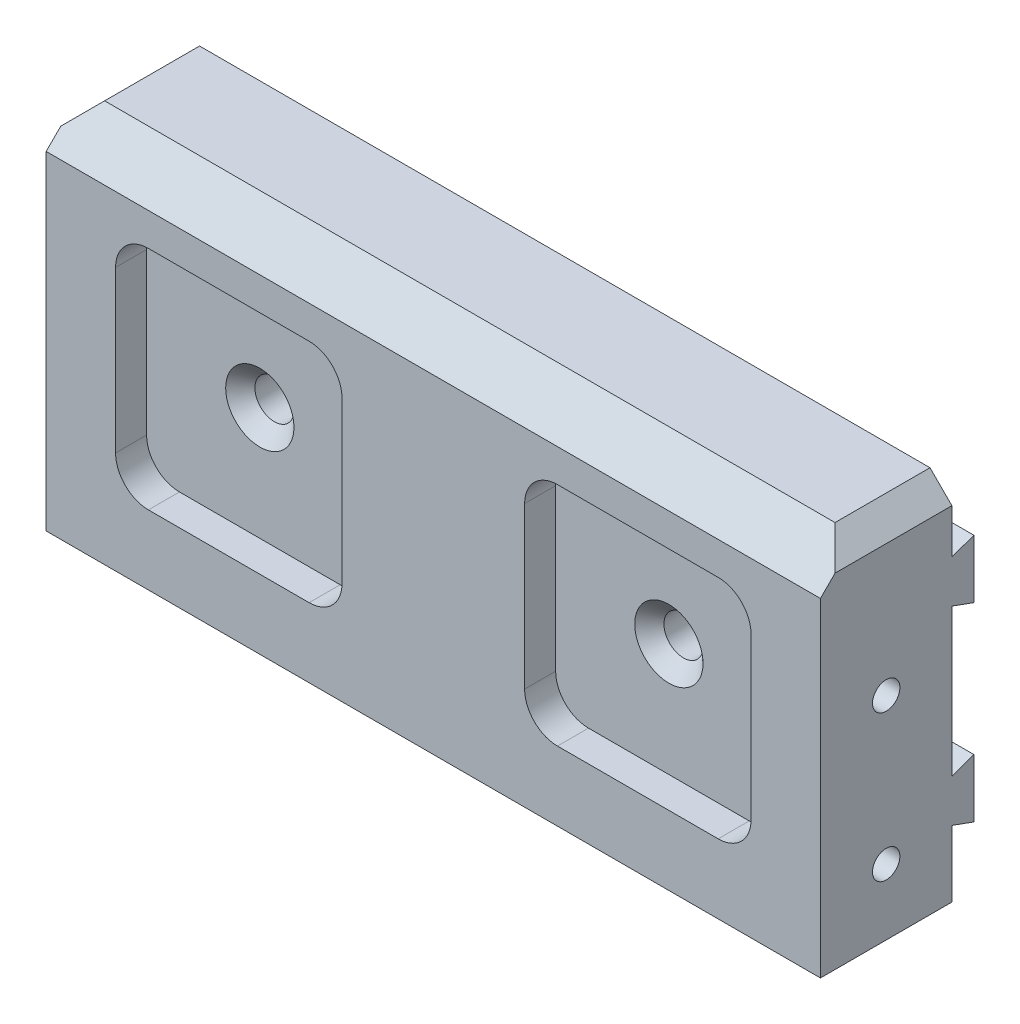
SolidWorks part; units mm, degrees
ref_plane "Спереди" through (0, 0, 0) normal (0, 0, 1) x (1, 0, 0)
ref_plane "Сверху" through (0, 0, 0) normal (0, 1, 0) x (1, 0, 0)
ref_plane "Справа" through (0, 0, 0) normal (1, 0, 0) x (0, 0, -1)
sketch "Эскиз1" plane through (0, 0, 0) normal (0, 0, 1) x (1, 0, 0)
  line L1 (-53, -25) -> (53, -25)
  line L2 (-53, -25) -> (-53, 25)
  line L3 (-53, 25) -> (53, 25)
  line L4 (53, -25) -> (53, 25)
  line L5 (-53, -25) -> (53, 25) construction
  line L6 (-53, 25) -> (53, -25) construction
  point P0 (0, 0)
  dimension "D1" = 106
  dimension "D2" = 50
extrude "Бобышка-Вытянуть1" add sketch "Эскиз1" along normal mid plane 18
chamfer "Фаска1" distance 5 angle 45 1 edges at (0, 25, 9)
sketch "Эскиз2" plane through (0, 0, 9) normal (0, 0, 1) x (1, 0, 0)
  line L4 (0, 0) -> (0, 33.1018) construction
  line L5 (0, -50) -> (0, 50) construction
  line L6 (-12.5, 11) -> (-12.5, -11)
  line L7 (-17, -15.5) -> (-39, -15.5)
  line L8 (43.5, -11) -> (43.5, 11)
  line L9 (39, 15.5) -> (17, 15.5)
  line L10 (17, -15.5) -> (39, -15.5)
  line L11 (12.5, 11) -> (12.5, -11)
  line L12 (43.5, -11) -> (43.5, 11)
  line L13 (39, 15.5) -> (17, 15.5)
  line L14 (17, -15.5) -> (39, -15.5)
  line L15 (12.5, 11) -> (12.5, -11)
  line L16 (-39, 15.5) -> (-17, 15.5)
  line L17 (-43.5, -11) -> (-43.5, 11)
  arc A4 (-12.5, -11) -> (-17, -15.5) centre (-17, -11) cw
  arc A5 (-17, 15.5) -> (-12.5, 11) centre (-17, 11) cw
  arc A6 (-43.5, 11) -> (-39, 15.5) centre (-39, 11) cw
  arc A7 (-39, -15.5) -> (-43.5, -11) centre (-39, -11) cw
  arc A8 (39, -15.5) -> (43.5, -11) centre (39, -11) ccw
  arc A9 (43.5, 11) -> (39, 15.5) centre (39, 11) ccw
  arc A10 (17, 15.5) -> (12.5, 11) centre (17, 11) ccw
  arc A11 (12.5, -11) -> (17, -15.5) centre (17, -11) ccw
  arc A12 (39, -15.5) -> (43.5, -11) centre (39, -11) ccw
  arc A13 (43.5, 11) -> (39, 15.5) centre (39, 11) ccw
  arc A14 (17, 15.5) -> (12.5, 11) centre (17, 11) ccw
  arc A15 (12.5, -11) -> (17, -15.5) centre (17, -11) ccw
  dimension "D1" = 0.5
extrude "Вырез-Вытянуть1" cut sketch "Эскиз2" against normal blind 4.25
sketch "Эскиз3" plane through (0, 0, -9) normal (0, 0, -1) x (-1, 0, 0)
  circle A0 centre (28, 0) radius 5 construction
  circle A1 centre (-28, 0) radius 5 construction
  circle A2 centre (28, 0) radius 5 construction
  circle A3 centre (-28, 0) radius 5 construction
  circle A4 centre (-28, 0) radius 2.675
  circle A5 centre (28, 0) radius 2.675
  dimension "D1" = 5.35
extrude "Вырез-Вытянуть2" cut sketch "Эскиз3" against normal through all
chamfer "Фаска2" distance 3 angle 45 2 edges at (-30.675, 0, -9) (25.325, 0, -9)
sketch "Эскиз4" plane through (-53, 0, 0) normal (-1, 0, 0) x (0, 0, 1)
  line L3 (-81.0045, 17) -> (-84.0045, 15.9081) construction
  line L4 (-81.0045, 9) -> (-81.0045, 17) construction
  line L5 (-84.0045, 10.0919) -> (-81.0045, 9) construction
  line L6 (-46.5023, 15.4081) -> (-46.5023, 2.7987) construction
  line L7 (-9, 10.0919) -> (-12, 9)
  line L8 (-12, 9) -> (-12, 17)
  line L9 (-12, 17) -> (-9, 15.9081)
  line L10 (-9, 15.9081) -> (-9, 10.0919)
  line L12 (0, 0) -> (-12.3873, 0) construction
  line L13 (-9, -15.9081) -> (-9, -10.0919)
  line L14 (-12, -17) -> (-9, -15.9081)
  line L15 (-12, -9) -> (-12, -17)
  line L16 (-9, -10.0919) -> (-12, -9)
  line L17 (-81.0045, 17) -> (-84.0045, 15.9081) construction
  line L18 (-81.0045, 9) -> (-81.0045, 17) construction
  line L19 (-84.0045, 10.0919) -> (-81.0045, 9) construction
  line L20 (-12, 13) -> (-10.2962, 13) construction
  line L21 (-12, -13) -> (-9.67, -13) construction
  line L22 (-9, 25) -> (-9, -25) construction
extrude "Бобышка-Вытянуть2" add sketch "Эскиз4" against normal up to surface (106 mm away)
chamfer "Фаска3" distance 3 angle 45 2 edges at (53, 25, -2.5) (-53, 25, -2.5)
sketch "Эскиз5" plane through (-53, 0, 0) normal (-1, 0, 0) x (0, 0, 1)
  circle A0 centre (0, 4) radius 1.875
  circle A1 centre (0, -16) radius 1.875
  dimension "D1" = 3.75
extrude "Вырез-Вытянуть4" cut sketch "Эскиз5" against normal blind 20
mirror "Зеркальное отражение1" about plane through (0, 0, 0) normal (1, 0, 0) of "Вырез-Вытянуть4"
chamfer "Фаска4" distance 2 angle 45 2 edges at (30.675, 0, 4.75) (-30.675, 0, 4.75)
